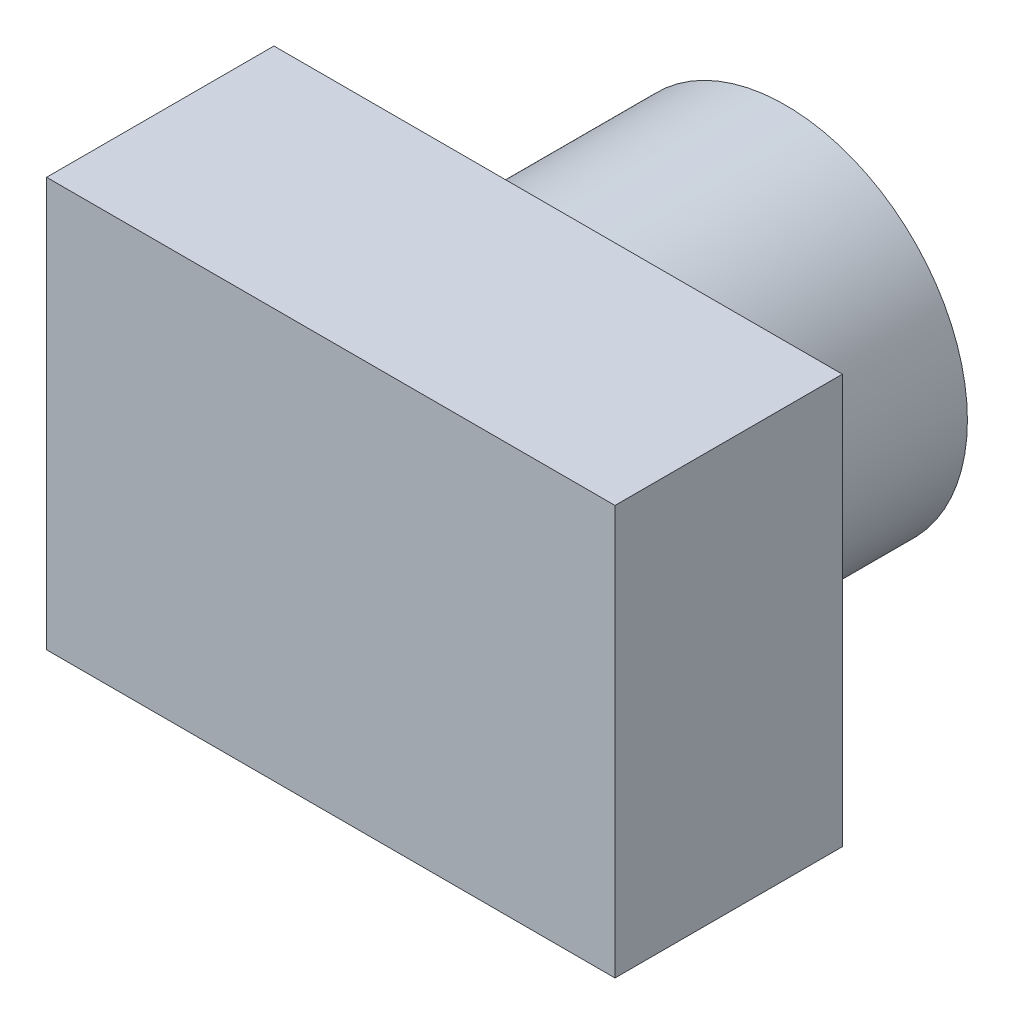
SolidWorks part; units mm, degrees
ref_plane "前基準面" through (0, 0, 0) normal (0, 0, 1) x (1, 0, 0)
ref_plane "上基準面" through (0, 0, 0) normal (0, 1, 0) x (1, 0, 0)
ref_plane "右基準面" through (0, 0, 0) normal (1, 0, 0) x (0, 0, -1)
sketch "草圖3" plane through (0, 0, 0) normal (0, 0, 1) x (1, 0, 0)
  line L1 (0, 0) -> (25, 0)
  line L2 (0, 0) -> (0, -18)
  line L3 (0, -18) -> (25, -18)
  line L4 (25, 0) -> (25, -18)
  dimension "D1" = 25
  dimension "D2" = 18
extrude "填料-伸長1" add sketch "草圖3" along normal blind 10
sketch "草圖4" plane through (0, 0, 0) normal (0, 0, -1) x (-1, 0, 0)
  line L0 (-25, 0) -> (0, 0) construction
  line L1 (-25, -18) -> (-25, 0) construction
  circle A0 centre (-12.5, -9) radius 8
  dimension "D1" = 16
  dimension "D2" = 9
  dimension "D3" = 12.5
extrude "填料-伸長2" add sketch "草圖4" along normal blind 10
